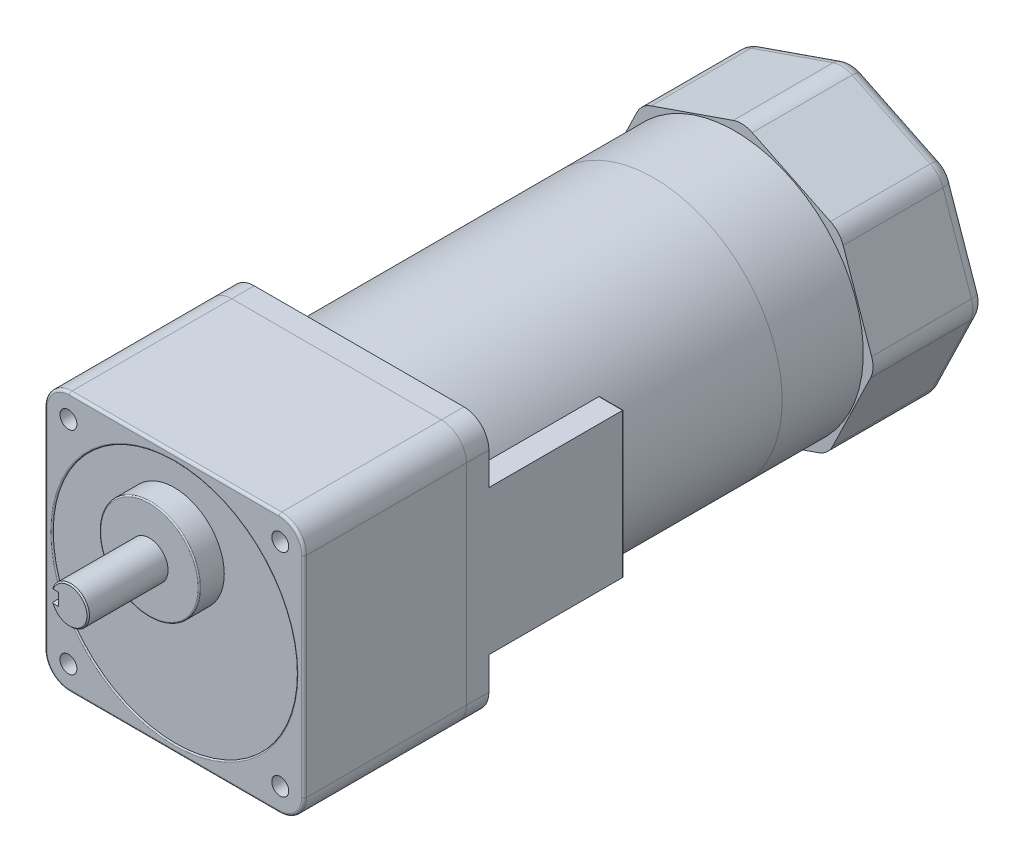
SolidWorks part; units mm, degrees
ref_plane "前视基准面" through (0, 0, 0) normal (0, 0, 1) x (1, 0, 0)
ref_plane "上视基准面" through (0, 0, 0) normal (0, 1, 0) x (1, 0, 0)
ref_plane "右视基准面" through (0, 0, 0) normal (1, 0, 0) x (0, 0, -1)
sketch "草图1" plane through (0, 0, 0) normal (0, 0, 1) x (1, 0, 0)
  line L1 (-42, -52) -> (42, -52)
  line L2 (-52, -42) -> (-52, 42)
  line L3 (-42, 52) -> (42, 52)
  line L4 (52, -42) -> (52, 42)
  line L5 (-52, -52) -> (52, 52) construction
  line L6 (-52, 52) -> (52, -52) construction
  arc A0 (-42, -52) -> (-52, -42) centre (-42, -42) cw
  arc A1 (-52, 42) -> (-42, 52) centre (-42, 42) cw
  arc A2 (42, 52) -> (52, 42) centre (42, 42) cw
  arc A3 (42, -52) -> (52, -42) centre (42, -42) ccw
  point P0 (0, 0)
  dimension "D1" = 10
extrude "凸台-拉伸1" add sketch "草图1" along normal blind 65
sketch "草图2" plane through (0, 0, 0) normal (0, 0, -1) x (-1, 0, 0)
  line L0 (52, 42) -> (52, -42) construction
  line L1 (-42, 52) -> (42, 52)
  line L2 (-52, 42) -> (-52, -42)
  line L3 (-42, -52) -> (42, -52)
  line L4 (52, 42) -> (52, -42)
  line L5 (-52, 52) -> (52, -52) construction
  line L6 (-52, -52) -> (52, 52) construction
  arc A0 (42, -52) -> (52, -42) centre (42, -42) ccw
  arc A1 (-52, -42) -> (-42, -52) centre (-42, -42) ccw
  arc A2 (-42, 52) -> (-52, 42) centre (-42, 42) ccw
  arc A3 (42, 52) -> (52, 42) centre (42, 42) cw
  point P0 (0, 0)
  dimension "D1" = 10
extrude "凸台-拉伸2" add sketch "草图2" along normal blind 9 separate body
sketch "草图3" plane through (0, 0, -9) normal (0, 0, -1) x (-1, 0, 0)
  line L0 (-52, 42) -> (-52, -42) construction
  line L1 (0, 29) -> (-52, 29)
  line L3 (0, -29) -> (-52, -29)
  line L4 (-52, 29) -> (-52, -29)
  line L8 (0, 29) -> (0, -29)
  point P0 (0, 0)
extrude "凸台-拉伸3" add sketch "草图3" along normal blind 54
sketch "草图4" plane through (0, 0, -9) normal (0, 0, -1) x (-1, 0, 0)
  circle A0 centre (0, 0) radius 51.5
extrude "凸台-拉伸4" add sketch "草图4" along normal blind 118 separate body
sketch "草图5" plane through (0, 0, -127) normal (0, 0, -1) x (-1, 0, 0)
  circle A0 centre (0, 0) radius 51.5
extrude "凸台-拉伸5" add sketch "草图5" along normal blind 32.5 separate body
sketch "草图6" plane through (0, 0, -159.5) normal (0, 0, -1) x (-1, 0, 0)
  line L1 (-7.0224, 54.3814) -> (-38.3332, 39.2074)
  line L2 (-43.419, 33.4879) -> (-54.8295, 0.6182)
  line L3 (-54.3814, -7.0224) -> (-39.2074, -38.3332)
  line L4 (-33.4879, -43.419) -> (-0.6182, -54.8295)
  line L5 (7.0224, -54.3814) -> (38.3332, -39.2074)
  line L6 (43.419, -33.4879) -> (54.8295, -0.6182)
  line L7 (54.3814, 7.0224) -> (39.2074, 38.3332)
  line L8 (33.4879, 43.419) -> (0.6182, 54.8295)
  circle A0 centre (0, 0) radius 52 construction
  arc A1 (-54.8295, 0.6182) -> (-54.3814, -7.0224) centre (-45.3825, -2.6612) ccw
  arc A2 (-39.2074, -38.3332) -> (-33.4879, -43.419) centre (-30.2085, -33.9721) ccw
  arc A3 (-0.6182, -54.8295) -> (7.0224, -54.3814) centre (2.6612, -45.3825) ccw
  arc A4 (38.3332, -39.2074) -> (43.419, -33.4879) centre (33.9721, -30.2085) ccw
  arc A5 (54.8295, -0.6182) -> (54.3814, 7.0224) centre (45.3825, 2.6612) ccw
  arc A6 (39.2074, 38.3332) -> (33.4879, 43.419) centre (30.2085, 33.9721) ccw
  arc A7 (-7.0224, 54.3814) -> (0.6182, 54.8295) centre (-2.6612, 45.3825) cw
  arc A8 (-38.3332, 39.2074) -> (-43.419, 33.4879) centre (-33.9721, 30.2085) ccw
  dimension "D1" = 10
extrude "凸台-拉伸6" add sketch "草图6" along normal blind 45 separate body
fillet "圆角1" radius 5 16 edges at (49.1243, 17.0531, -204.5) (41.4449, 36.8535, -204.5) (22.6778, 46.7944, -204.5) (3.2466, 55.3654, -204.5) (-17.0531, 49.1243, -204.5) (-36.8535, 41.4449, -204.5) (-46.7944, 22.6778, -204.5) (-55.3654, 3.2466, -204.5) (-49.1243, -17.0531, -204.5) (-41.4449, -36.8535, -204.5) (-22.6778, -46.7944, -204.5) (-3.2466, -55.3654, -204.5) (17.0531, -49.1243, -204.5) (36.8535, -41.4449, -204.5) (46.7944, -22.6778, -204.5) (55.3654, -3.2466, -204.5)
fillet "圆角2" radius 1 8 edges at (-52, 0, 65) (-49.0711, 49.0711, 65) (0, 52, 65) (49.0711, 49.0711, 65) (52, 0, 65) (49.0711, -49.0711, 65) (0, -52, 65) (-49.0711, -49.0711, 65)
fillet "圆角3" radius 0.5 3 edges at (26, -29, -63) (26, 29, -63) (52, 0, -63)
sketch "草图7" plane through (0, 0, 65) normal (0, 0, 1) x (1, 0, 0)
  point P19 (-42.4264, 42.4264)
  point P20 (-42.4264, -42.4264)
  point P21 (42.4264, -42.4264)
  point P22 (42.4264, 42.4264)
sketch "草图9" plane through (0, 0, -9) normal (0, 0, -1) x (-1, 0, 0)
  circle A5 centre (-42.4264, -42.4264) radius 4.5
  circle A6 centre (42.4264, -42.4264) radius 4.5
  circle A7 centre (-42.4264, 42.4264) radius 4.5
  circle A8 centre (42.4264, 42.4264) radius 4.5
extrude "切除-拉伸1" cut sketch "草图9" against normal blind 51.75
hole_wizard "M8 螺纹孔2" positions "3D草图4" profile "草图11" tap size "M8" standard "GB"
sketch3d "3D草图4"
  point P0 (-42.4264, 42.4264, 65)
  point P3 (42.4264, 42.4264, 65)
  point P6 (42.4264, -42.4264, 65)
  point P9 (-42.4264, -42.4264, 65)
sketch "草图11" plane through (-42.4264, 42.4264, 65) normal (1, 0, 0) x (0, -1, 0)
  line L0 (0, 0) -> (0, 24.2929)
  line L1 (0, 24.2929) -> (3.4, 22.25)
  line L2 (3.4, 22.25) -> (3.4, 0)
  line L5 (3.4, 0) -> (0, 0)
  line L10 (0, 24.2929) -> (-3.4, 22.25) construction
  line L11 (0, -6.35) -> (0, 107.95) construction
  dimension "螺纹孔钻头直径" = 6.8
  dimension "螺纹孔钻头深度" = 22.25
  dimension "导头角度" = 118
sketch "草图12" plane through (0, 0, 65) normal (0, 0, 1) x (1, 0, 0)
  circle A0 centre (0, 20) radius 20
extrude "凸台-拉伸7" add sketch "草图12" along normal blind 10 separate body
fillet "圆角4" radius 0.5 1 edges at (20, 20, 75)
sketch "草图13" plane through (0, 0, 75) normal (0, 0, 1) x (1, 0, 0)
  circle A0 centre (0, 20) radius 7.5
extrude "凸台-拉伸8" add sketch "草图13" along normal blind 32 separate body
ref_plane "基准面1" through (-7.5, 0, 0) normal (1, 0, 0) x (0, 0, -1)
chamfer "倒角2" distance 0.5 angle 45 1 edges at (7.5, 20, 107)
sketch "草图16" plane through (0, 0, 65) normal (0, 0, 1) x (1, 0, 0)
  circle A0 centre (0, 0) radius 49
extrude "切除-拉伸3" cut sketch "草图16" against normal blind 0.5
fillet "圆角5" radius 0.5 1 edges at (49, 0, 65)
sketch "草图18" plane through (-7.5, 0, 0) normal (1, 0, 0) x (0, 0, -1)
  line L1 (-107, 27) -> (-107, 13) construction
  line L2 (-84.5, 22.5) -> (-107, 22.5)
  line L3 (-107, 22.5) -> (-107, 17.5)
  line L4 (-107, 17.5) -> (-84.5, 17.5)
  arc A0 (-84.5, 17.5) -> (-84.5, 22.5) centre (-84.5, 20) ccw
extrude "切除-拉伸6" cut sketch "草图18" along normal blind 3
